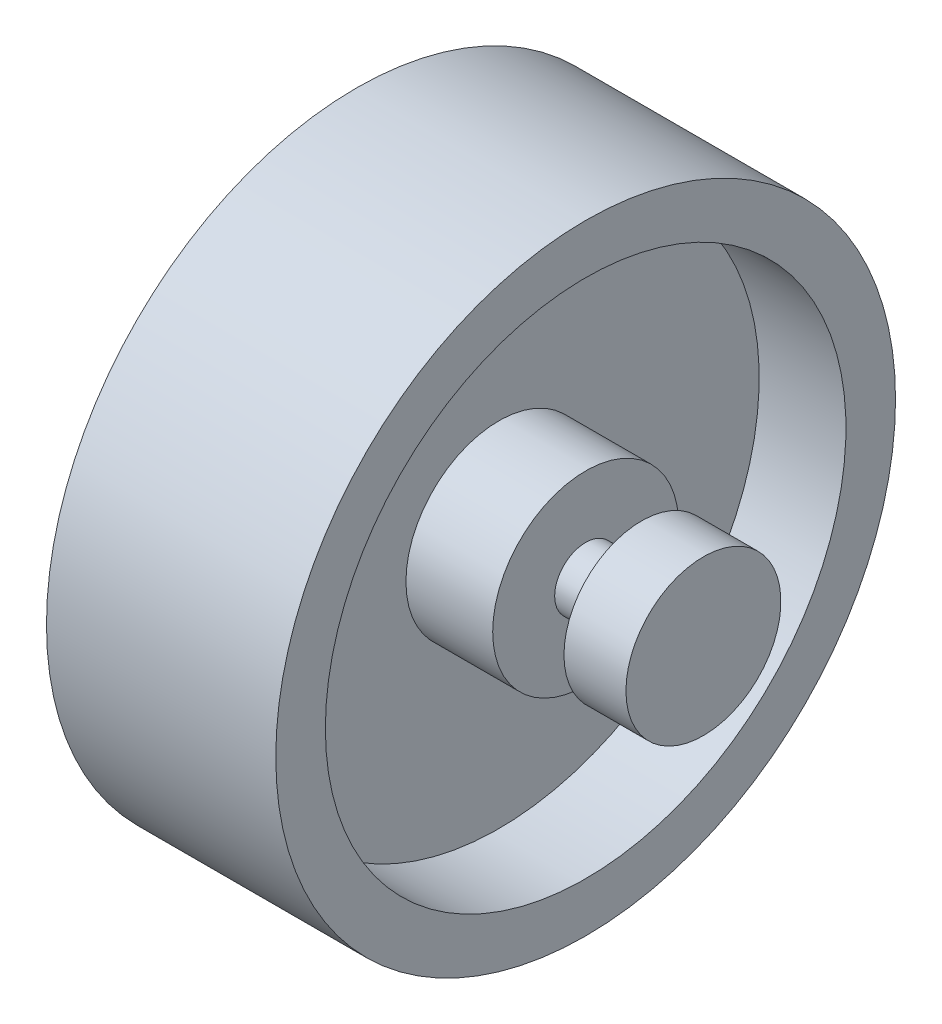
SolidWorks part; units mm, degrees
ref_plane "Plan de face" through (0, 0, 0) normal (0, 0, 1) x (1, 0, 0)
ref_plane "Plan de dessus" through (0, 0, 0) normal (0, 1, 0) x (1, 0, 0)
ref_plane "Plan de droite" through (0, 0, 0) normal (1, 0, 0) x (0, 0, -1)
sketch "Esquisse1" plane through (0, 0, 0) normal (0, 0, 1) x (1, 0, 0)
  line L0 (-37.5, 0) -> (37.5, 0)
  line L1 (37.5, 0) -> (37.5, 12.5)
  line L2 (37.5, 12.5) -> (27.5, 12.5)
  line L3 (27.5, 12.5) -> (27.5, 5)
  line L4 (27.5, 5) -> (18.5, 5)
  line L5 (18.5, 5) -> (18.5, 15)
  line L6 (18.5, 50) -> (-18.5, 50)
  line L7 (-18.5, 50) -> (-18.5, 42)
  line L8 (-18.5, 5) -> (-27.5, 5)
  line L9 (-27.5, 5) -> (-27.5, 12.5)
  line L10 (-27.5, 12.5) -> (-37.5, 12.5)
  line L11 (-37.5, 12.5) -> (-37.5, 0)
  line L12 (18.5, 42) -> (4.5, 42)
  line L13 (4.5, 42) -> (4.5, 15)
  line L14 (4.5, 15) -> (18.5, 15)
  line L15 (-18.5, 42) -> (-4.5, 42)
  line L16 (-4.5, 42) -> (-4.5, 15)
  line L17 (-4.5, 15) -> (-18.5, 15)
  line L18 (-18.5, 15) -> (-18.5, 5)
  line L19 (18.5, 42) -> (18.5, 50)
  point P13 (0, 50)
  dimension "D1" = 37
  dimension "D2" = 55
  dimension "D3" = 27.5
  dimension "D4" = 50
  dimension "D5" = 75
  dimension "D6" = 5
  dimension "D7" = 12.5
  dimension "D8" = 10
  dimension "D9" = 15
  dimension "D10" = 14
  dimension "D11" = 14
  dimension "D12" = 8
revolve "Révolution1" add sketch "Esquisse1" angle 360 about L0
